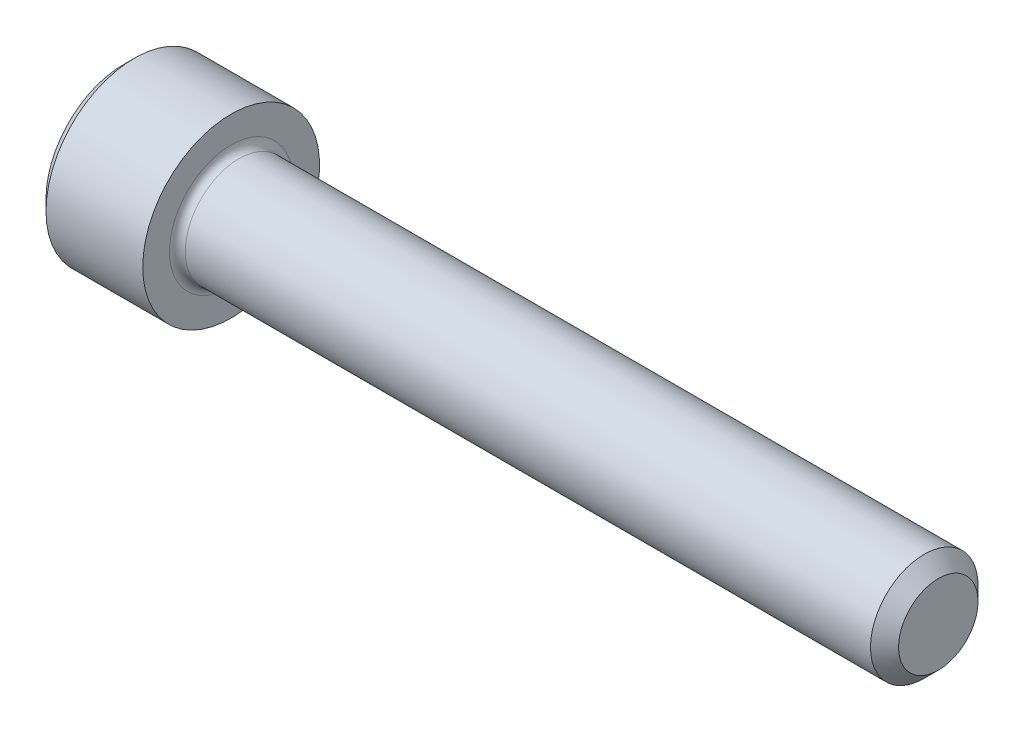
SolidWorks part; units mm, degrees
revolve "Base-Revolve" add sketch "BodySke"
sketch "BodySke" plane through (0, 0, 0) normal (0, 0, 1) x (1, 0, 0)
  line L0 (0, 0) -> (0, 3.4861)
  line L1 (0.4826, 3.9688) -> (4.826, 3.9688)
  line L2 (4.826, 3.9688) -> (4.826, 2.413)
  line L3 (4.826, 2.413) -> (35.9461, 2.413)
  line L4 (36.576, 1.7831) -> (36.576, 0)
  line L5 (36.576, 0) -> (0, 0)
  line L6 (-31.75, 0) -> (127, 0) construction
  line L7 (0, 3.4861) -> (0.4826, 3.9688)
  line L8 (36.576, 1.7831) -> (35.9461, 2.413)
  line L9 (0, -3.4861) -> (0.4826, -3.9688) construction
  line L10 (36.576, -1.7831) -> (35.9461, -2.413) construction
  line L11 (5.8852, 9.525) -> (5.8852, 3.175) construction
  line L12 (14.351, 9.525) -> (14.351, 3.175) construction
  line L13 (-1.524, 9.525) -> (-1.524, 3.175) construction
  dimension "Diameter" = 4.826
  dimension "Head_ht" = 4.826
  dimension "Length" = 31.75
  dimension "Body_ch_ang" = 45
  dimension "Head_dia" = 7.9375
  dimension "Head_ch_ang" = 45
  dimension "Head_side_ht" = 4.3434
  dimension "Minor_dia" = 3.5662
  dimension "Advance" = 1.0592
  dimension "Thread_nom" = 22.225
  dimension "Thread_length" = 38.1
fillet "Fillet1" radius 0.3556 1 edges at (4.826, 0, 2.413)
ref_plane "Plane1" through (0, 0, 0) normal (0, 0, 1) x (1, 0, 0)
ref_plane "Plane2" through (0, 0, 0) normal (0, 1, 0) x (1, 0, 0)
ref_plane "Plane3" through (0, 0, 0) normal (1, 0, 0) x (0, 0, -1)
sketch "Sketch2" plane through (0, 0, 0) normal (0, 0, 1) x (1, 0, 0)
  line L0 (0, 1.985) -> (2.286, 1.985)
  line L1 (2.286, 1.985) -> (3.432, 0)
  line L2 (-31.75, 0) -> (127, 0) construction
  line L3 (3.432, 0) -> (0, 0)
  line L4 (0, 0) -> (0, 1.985)
  line L5 (0, 3.4861) -> (0, -3.4861) construction
  line L6 (0, 0) -> (47.625, 0) construction
  line L7 (4.826, -3.9688) -> (4.826, 3.9688) construction
revolve "Hex-PreBroach" cut sketch "Sketch2" angle 360 about L6
sketch "Sketch3" plane through (0, 0, 0) normal (-1, 0, 0) x (0, 0.5, 0.866)
  line L0 (1.146, 1.985) -> (-1.146, 1.985)
  line L1 (-1.146, 1.985) -> (-2.2921, 0)
  line L2 (1.146, 1.985) -> (2.2921, 0)
  line L3 (1.146, -1.985) -> (2.2921, 0)
  line L4 (1.146, -1.985) -> (-1.146, -1.985)
  line L5 (-1.146, -1.985) -> (-2.2921, 0)
extrude "Hex" cut sketch "Sketch3" against normal blind 2.286
sketch "Sketch4" plane through (0, 0, 0) normal (-1, 0, 0) x (0, 0, 1)
  line L0 (0, 0) -> (2.3876, 0)
  line L1 (0, 0) -> (6.1484, 3.5498) construction
  line L2 (0, 0) -> (1.1938, 2.0677)
  line L3 (1.9883, 0.576) -> (2.2704, 0.7389)
  line L4 (1.493, 1.4339) -> (1.7751, 1.5968)
  arc A0 (1.9883, 0.576) -> (1.493, 1.4339) centre (0, 0) ccw
  arc A1 (2.3876, 0) -> (2.2704, 0.7389) centre (0, 0) ccw
  arc A2 (1.1938, 2.0677) -> (1.7751, 1.5968) centre (0, 0) cw
extrude "Spline" [suppressed] cut sketch "Sketch4" against normal blind 2.286
pattern_circular "CirPattern1" [suppressed] count 6 every 60
sketch "Sketch5" plane through (0, 0, 0) normal (0, 0, 1) x (1, 0, 0)
  line L0 (-31.75, 0) -> (127, 0) construction
  line L2 (0, 3.4861) -> (0, -3.4861) construction
  circle A0 centre (1.651, 0) radius 0.5906
  dimension "Drilled_hole_dia" = 1.1811
  dimension "Drilled_hole_loc" = 1.651
extrude "Hole" [suppressed] cut sketch "Sketch5" against normal through all and the other way through all
pattern_circular "Drilled-4" [suppressed] count 2 every 60
pattern_circular "Drilled-6" [suppressed] count 3 every 60
sketch "ThdSchSke" plane through (0, 0, 0) normal (0, 0, 1) x (1, 0, 0)
  line L0 (14.351, -1.7831) -> (13.9099, -2.413)
  line L1 (14.351, -1.7831) -> (14.7921, -2.413)
  line L2 (14.7921, -2.413) -> (14.7921, -3.0162)
  line L3 (-3.175, 0) -> (5.1513, 0) construction
  line L5 (14.7921, -3.0162) -> (13.9099, -3.0162)
  line L6 (13.9099, -3.0162) -> (13.9099, -2.413)
  line L7 (0, 3.4861) -> (0, -3.4861) construction
revolve "ThreadSchematic" [suppressed] cut sketch "ThdSchSke" angle 360 about L3
pattern_linear "ThdSchPat" [suppressed]
equation "\"D2@Sketch3\" = \"Hex_size@Sketch3\" / 2"
equation "\"D1@Sketch3\" = \"Hex_size@Sketch3\" / 2"
equation "\"D1@Sketch2\" = \"Hex_size@Sketch3\" / 2"
equation "\"D3@Sketch4\" = \"Spline_p_dim@Sketch4\" / 2"
equation "\"Thread_minor@ThreadCosmetic\"  =  \"Minor_dia@BodySke\""
equation "\"D2@CirPattern1\" = 360 / \"Num_teeth@CirPattern1\""
equation "\"Wall_thickness@Sketch2\" = \"Head_ht@BodySke\" - \"Key_eng@Hex\""
equation "\"Thread_length@ThreadCosmetic\" = ((sgn( (\"Length@BodySke\" - \"Advance@BodySke\" ) - \"Thread_nom@BodySke\" )-1)*( (\"Length@BodySke\" - \"Advance@BodySke\" ) - \"Thread_nom@BodySke\" ))/-2+ \"Thread_nom@BodySke\""
equation "\"Thread_minor@ThdSchSke\" = \"Minor_dia@BodySke\""
equation "\"Diameter@ThdSchSke\" = \"Diameter@BodySke\""
equation "\"Overcut@ThdSchSke\" = \"Diameter@BodySke\" * 1.25"
equation "\"Start@ThdSchSke\" = \"Head_ht@BodySke\" + \"Length@BodySke\" - \"Thread_length@ThreadCosmetic\"  '---Non-countersunk---"
equation "\"Num_threads@ThdSchPat\" = int( \"Thread_length@ThreadCosmetic\" / \"Advance@BodySke\" + 0.999 )  + 1"
equation "\"Advance@ThdSchPat\" = \"Thread_length@ThreadCosmetic\" /  (\"Num_threads@ThdSchPat\" - 1) 'relax it"
equation "\"Num_threads@ThdSchPat\" = \"Num_threads@ThdSchPat\" - sgn( \"Num_threads@ThdSchPat\" - 1) '---chamfered tips only---"
